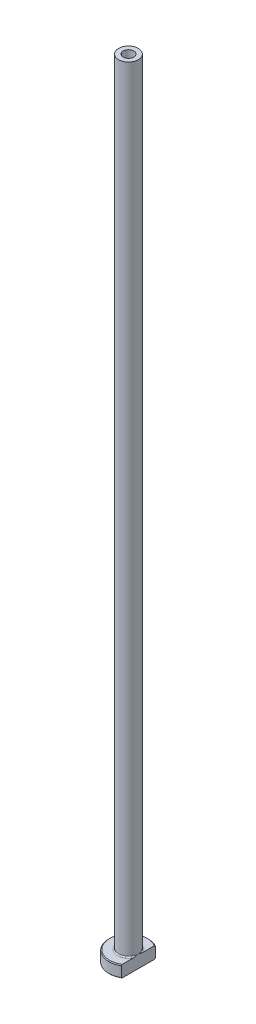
SolidWorks part; units mm, degrees
ref_plane "Front Plane" through (0, 0, 0) normal (0, 0, 1) x (1, 0, 0)
ref_plane "Top Plane" through (0, 0, 0) normal (0, 1, 0) x (1, 0, 0)
ref_plane "Right Plane" through (0, 0, 0) normal (1, 0, 0) x (0, 0, -1)
sketch "Sketch1" plane through (0, 0, 0) normal (0, 0, 1) x (1, 0, 0)
  line L0 (-1.35, 200) -> (-2.5, 200)
  line L1 (-2.5, 200) -> (-2.5, 3)
  line L2 (-2.5, 3) -> (-5, 3)
  line L3 (-5, 3) -> (-5, 0)
  line L4 (4.125, 0) -> (-4.125, 0) construction
  line L5 (-5, 0) -> (-1.6, 0)
  line L6 (-1.35, 155) -> (-1.35, 200)
  line L7 (0, 92.1877) -> (0, -15.5353) construction
  line L8 (0, -5.5) -> (0, 5.5) construction
  line L9 (-1.35, 155) -> (-1.6, 143)
  line L10 (-1.6, 143) -> (-1.6, 0)
  dimension "D1" = 0.25
  dimension "ID" = 2.7
  dimension "OD" = 5
  dimension "L" = 200
  dimension "H" = 10
  dimension "T" = 3
  dimension "N" = 45
  dimension "D2" = 12
  dimension "L-N" = 155
revolve "Revolve1" add sketch "Sketch1" angle 360 about L7
fillet "Fillet1" radius 0.3 1 edges at (0, 3, 2.5)
chamfer "Chamfer1" distance 0.2 angle 45 2 edges at (0, 3, 5) (0, 0, 5)
sketch "Sketch2" plane through (0, 0, 0) normal (0, -1, 0) x (1, 0, 0)
  line L0 (2.5, 4.3301) -> (2.5, -4.3301)
  circle A0 centre (0, 0) radius 5 construction
  arc A1 (2.5, 4.3301) -> (2.5, -4.3301) centre (0, 0) cw
  circle A2 centre (0, 0) radius 2.5 construction
extrude "Cut-Extrude1" cut sketch "Sketch2" against normal through all
chamfer "Chamfer2" distance 0.5 angle 45 1 edges at (0, 0, 1.6)
